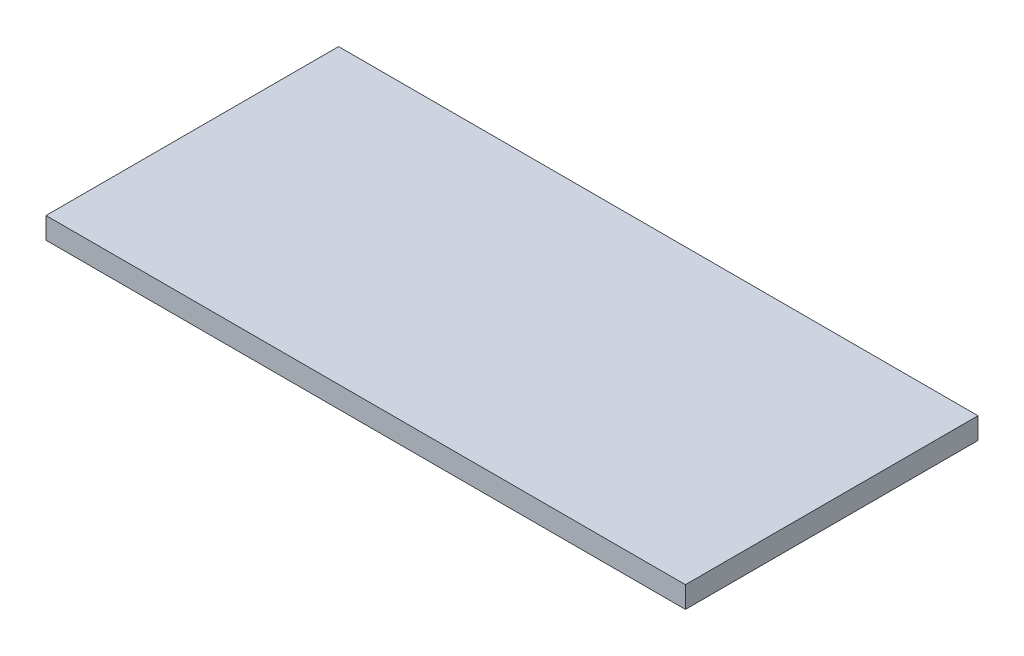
SolidWorks part; units mm, degrees
ref_plane "Plan de face" through (0, 0, 0) normal (0, 0, 1) x (1, 0, 0)
ref_plane "Plan de dessus" through (0, 0, 0) normal (0, 1, 0) x (1, 0, 0)
ref_plane "Plan de droite" through (0, 0, 0) normal (1, 0, 0) x (0, 0, -1)
sketch "Esquisse1" plane through (0, 0, 0) normal (0, 1, 0) x (1, 0, 0)
  line L1 (-152, 69.55) -> (152, 69.55)
  line L2 (-152, 69.55) -> (-152, -69.55)
  line L3 (-152, -69.55) -> (152, -69.55)
  line L4 (152, 69.55) -> (152, -69.55)
  line L5 (-152, 69.55) -> (152, -69.55) construction
  line L6 (-152, -69.55) -> (152, 69.55) construction
  point P0 (0, 0)
  dimension "D1" = 304
  dimension "D2" = 139.1
extrude "Boss.-Extru.1" add sketch "Esquisse1" along normal mid plane 10.2
